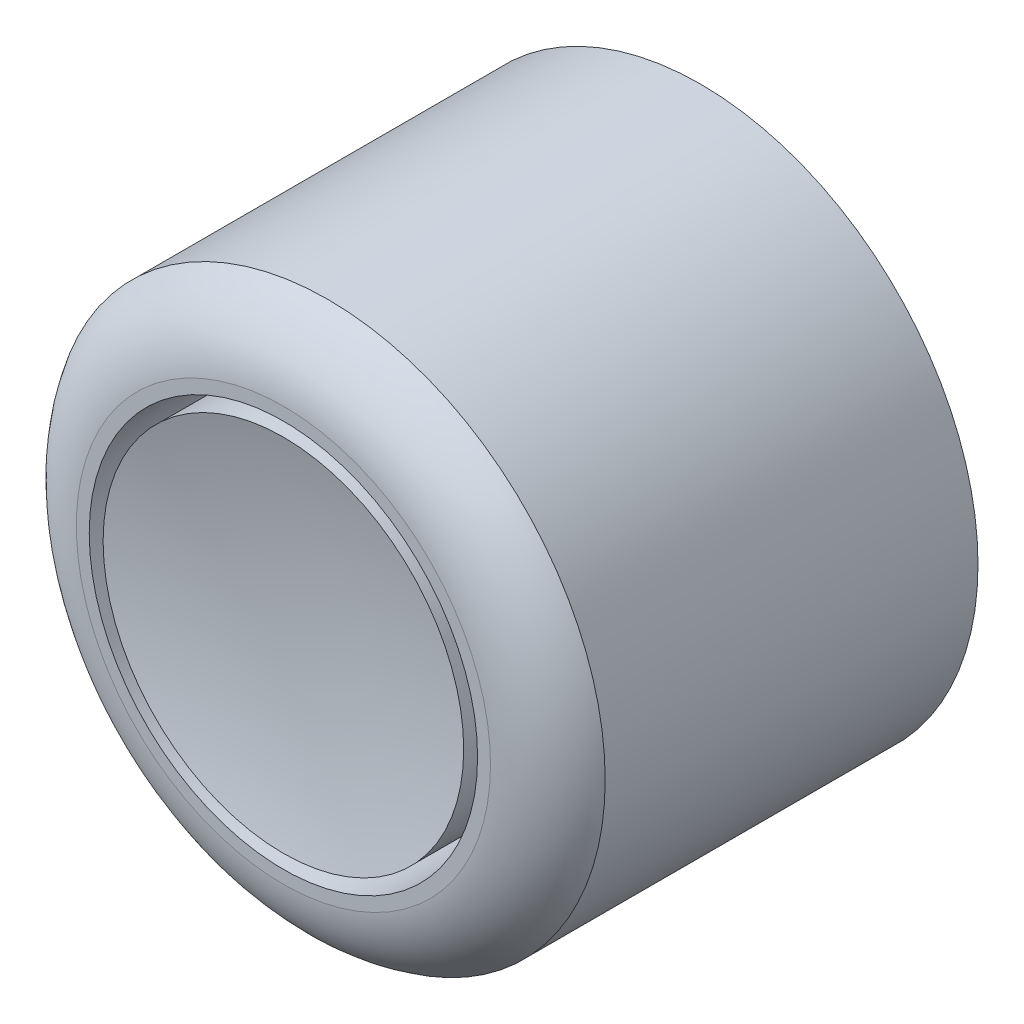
SolidWorks part; units mm, degrees
ref_plane "Front Plane" through (0, 0, 0) normal (0, 0, 1) x (1, 0, 0)
ref_plane "Top Plane" through (0, 0, 0) normal (0, 1, 0) x (1, 0, 0)
ref_plane "Right Plane" through (0, 0, 0) normal (1, 0, 0) x (0, 0, -1)
sketch "Sketch1" plane through (0, 0, 0) normal (1, 0, 0) x (0, 0, -1)
  line L0 (0, 0) -> (23.876, 0)
  line L1 (23.876, 0) -> (23.876, 15.875)
  line L2 (23.876, 15.875) -> (0, 15.875)
  line L3 (0, 15.875) -> (0, 11.1125)
  line L4 (0, 11.1125) -> (12.7, 11.1125)
  line L5 (12.7, 11.1125) -> (12.7, 10.3188)
  line L6 (12.7, 10.3188) -> (0, 10.3187)
  line L7 (0, 10.3187) -> (0, 0)
  line L8 (0, 10.3187) -> (0, -12.6309) construction
  line L9 (2.54, 15.875) -> (0, 15.875)
  arc A0 (0, 10.3187) -> (0, -10.3187) centre (-41.2849, 0) cw
  arc A1 (0, 11.1125) -> (2.54, 15.875) centre (5.0429, 11.4815) cw
  point P15 (1.27, 0)
  dimension "D6" = 1.27
  dimension "D1" = 15.875
  dimension "D2" = 10.3187
  dimension "D3" = 0.7937
  dimension "D4" = 23.876
  dimension "D5" = 12.7
  dimension "D7" = 2.54
revolve "Revolve1" add sketch "Sketch1" angle 360 about L0
